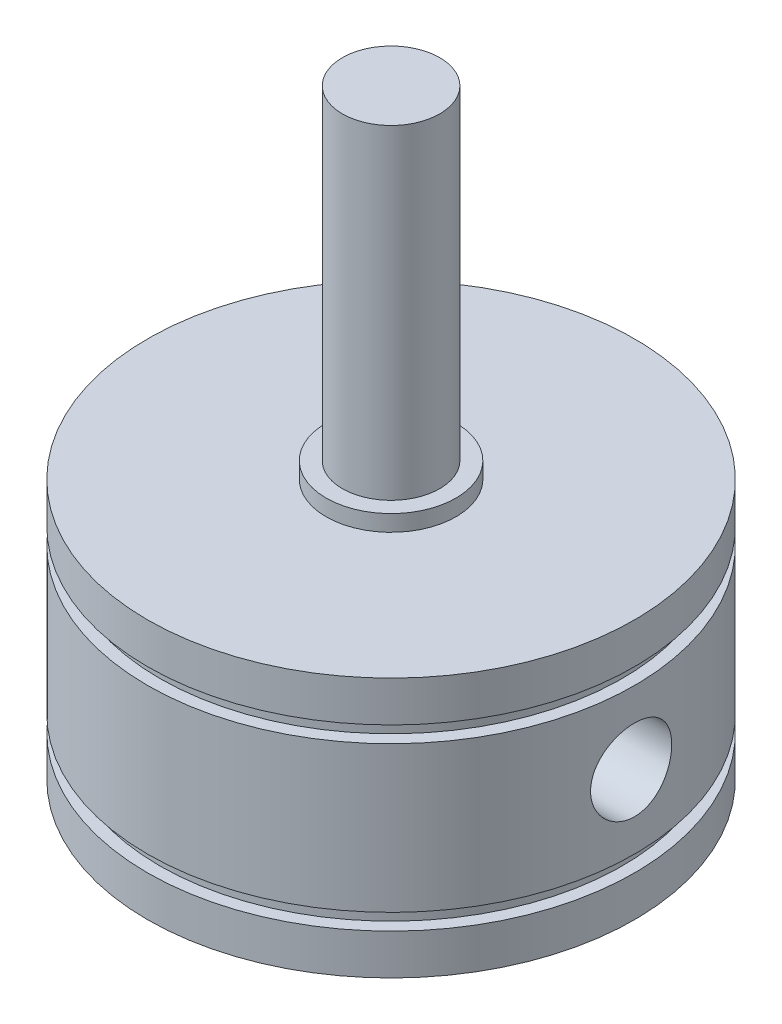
SolidWorks part; units mm, degrees
ref_plane "Plano frontal" through (0, 0, 0) normal (0, 0, 1) x (1, 0, 0)
ref_plane "Plano superior" through (0, 0, 0) normal (0, 1, 0) x (1, 0, 0)
ref_plane "Plano direito" through (0, 0, 0) normal (1, 0, 0) x (0, 0, -1)
sketch "Esboço2" plane through (0, 0, 0) normal (0, 0, 1) x (1, 0, 0)
  line L0 (0, 0) -> (0, 41)
  line L1 (0, 41) -> (3, 41)
  line L2 (3, 41) -> (3, 21)
  line L3 (3, 21) -> (4, 21)
  line L4 (4, 21) -> (4, 20)
  line L5 (4, 20) -> (15, 20)
  line L6 (15, 20) -> (15, 17.5)
  line L7 (15, 17.5) -> (14.25, 17.5)
  line L8 (14.25, 17.5) -> (14.25, 16.5)
  line L9 (14.25, 16.5) -> (15, 16.5)
  line L10 (15, 16.5) -> (15, 7.5)
  line L11 (15, 7.5) -> (14.25, 7.5)
  line L12 (14.25, 7.5) -> (14.25, 6.5)
  line L13 (14.25, 6.5) -> (15, 6.5)
  line L14 (15, 6.5) -> (15, 4)
  line L15 (15, 4) -> (4, 4)
  line L16 (4, 4) -> (4, 3)
  line L17 (4, 3) -> (3, 3)
  line L18 (3, 3) -> (3, 0)
  line L19 (3, 0) -> (0, 0)
  line L20 (0, 52.8834) -> (0, -8.8878) construction
  dimension "D1" = 41
  dimension "D2" = 16
  dimension "D3" = 3
  dimension "D4" = 1
  dimension "D5" = 1
  dimension "D6" = 20
  dimension "D7" = 3
  dimension "D8" = 3
  dimension "D9" = 11
  dimension "D10" = 2.5
  dimension "D11" = 0.75
  dimension "D12" = 1
  dimension "D13" = 4
revolve "Revolução" add sketch "Esboço2" angle 360 about L20
ref_plane "Plano1" through (-15, 0, 0) normal (-1, 0, 0) x (0, 0, 1)
sketch "Esboço4" plane through (-15, 0, 0) normal (-1, 0, 0) x (0, 0, 1)
  circle A0 centre (0, 12) radius 2.5
  dimension "D1" = 5
extrude "Furo perpendicular" cut sketch "Esboço4" against normal through all
ref_plane "Plano2" through (-13.5946, 0, 6.3393) normal (-0.9063, 0, 0.4226) x (0, 1, 0)
ref_plane "Plano4" through (-14.6444, 0, 3.2466) normal (-0.9763, 0, 0.2164) x (0, 1, 0)
sketch "Esboço11" plane through (-14.6444, 0, 3.2466) normal (-0.9763, 0, 0.2164) x (0, 1, 0)
  line L0 (11.7807, 5.446) -> (11.7807, -5.554) construction
  line L1 (14.7807, 5.446) -> (14.7807, -5.554)
  line L2 (8.7807, 5.446) -> (8.7807, -5.554)
  arc A0 (14.7807, 5.446) -> (8.7807, 5.446) centre (11.7807, 5.446) ccw
  arc A1 (8.7807, -5.554) -> (14.7807, -5.554) centre (11.7807, -5.554) ccw
  point P2 (11.7807, -0.054)
  dimension "D1" = 6
  dimension "D2" = 11
sketch "Esboço12" plane through (0, 0, 0) normal (1, 0, 0) x (0, 0, -1)
  circle A0 centre (0, 12) radius 2.5
  dimension "D1" = 5
loft "Loft de corte1" cut profiles "Esboço11", "Esboço12"
